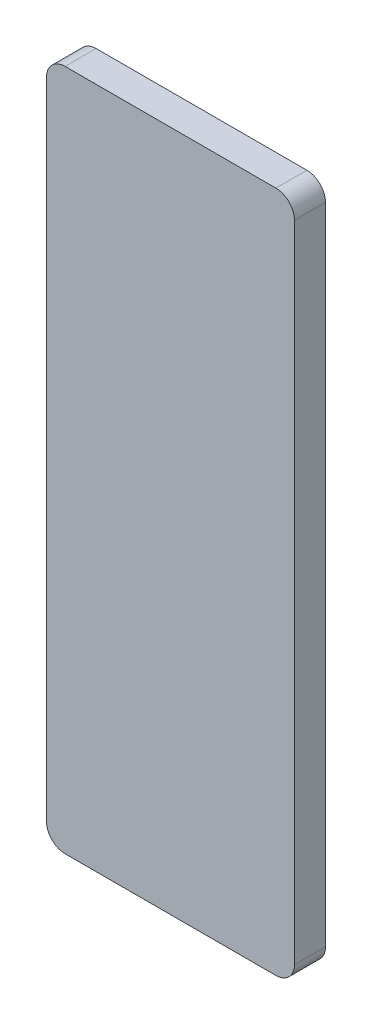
SolidWorks part; units mm, degrees
ref_plane "Front Plane" through (0, 0, 0) normal (0, 0, 1) x (1, 0, 0)
ref_plane "Top Plane" through (0, 0, 0) normal (0, 1, 0) x (1, 0, 0)
ref_plane "Right Plane" through (0, 0, 0) normal (1, 0, 0) x (0, 0, -1)
sketch "Sketch1" plane through (0, 0, 0) normal (0, 0, 1) x (1, 0, 0)
  line L1 (20, -55) -> (-20, -55)
  line L2 (20, -55) -> (20, 55)
  line L3 (20, 55) -> (-20, 55)
  line L4 (-20, -55) -> (-20, 55)
  line L5 (20, -55) -> (-20, 55) construction
  line L6 (20, 55) -> (-20, -55) construction
  point P0 (0, 0)
  dimension "D1" = 110
  dimension "D2" = 40
extrude "Boss-Extrude1" add sketch "Sketch1" along normal mid plane 5
fillet "Fillet1" radius 3 4 edges at (-20, -55, 0) (20, -55, 0) (20, 55, 0) (-20, 55, 0)
